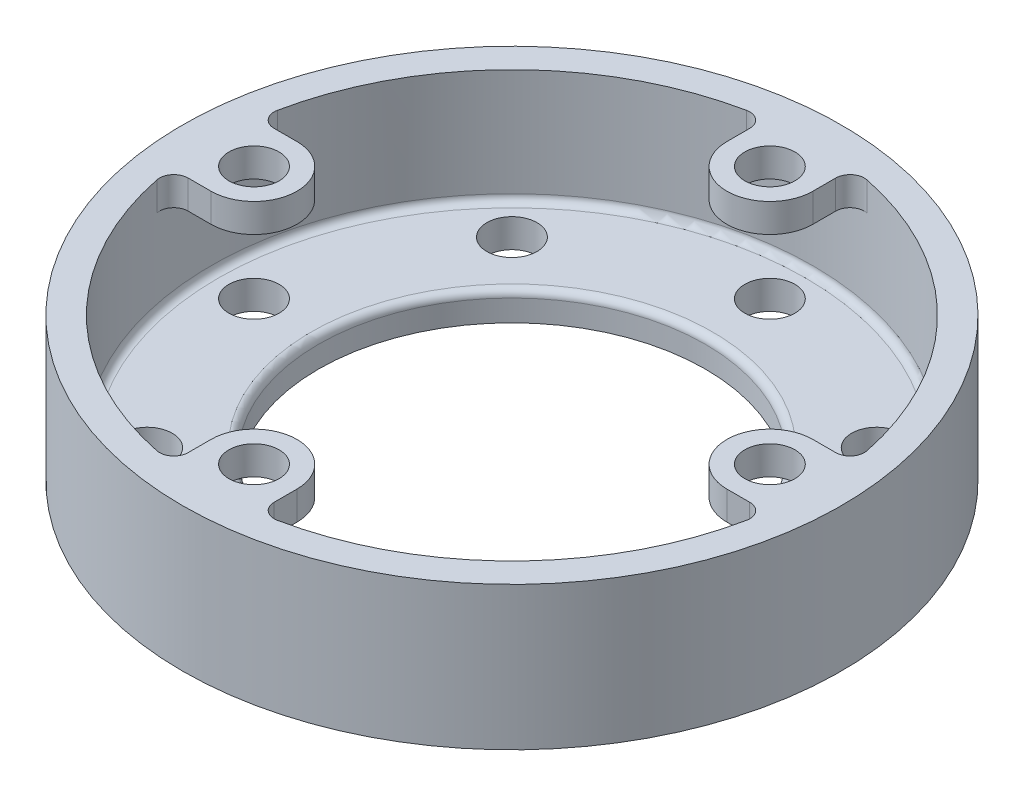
SolidWorks part; units mm, degrees
ref_plane "Front" through (0, 0, 0) normal (0, 0, 1) x (1, 0, 0)
ref_plane "Top" through (0, 0, 0) normal (0, 1, 0) x (1, 0, 0)
ref_plane "Right" through (0, 0, 0) normal (1, 0, 0) x (0, 0, -1)
sketch "Sketch1" plane through (0, 0, 0) normal (0, 1, 0) x (1, 0, 0)
  circle A0 centre (0, 0) radius 73.025
  dimension "D1" = 146.05
extrude "Base-Extrude" add sketch "Sketch1" along normal blind 31.75
shell "Shell1" thickness 6.35
sketch "Sketch4" plane through (0, 6.35, 0) normal (0, 1, 0) x (-1, 0, 0)
  circle A0 centre (0, 0) radius 42.8625
  dimension "D1" = 85.725
extrude "Cut-Extrude2" cut sketch "Sketch4" against normal through all
sketch "Sketch2" plane through (0, 31.75, 0) normal (0, 1, 0) x (-1, 0, 0)
  line L0 (0, -73.025) -> (0, 73.025) construction
  line L1 (-9.525, -65.9911) -> (-9.525, -57.15)
  line L2 (9.525, -57.15) -> (9.525, -65.9911)
  circle A0 centre (0, 0) radius 73.025 construction
  arc A1 (-9.525, -65.9911) -> (9.525, -65.9911) centre (0, 0) ccw
  circle A2 centre (0, 0) radius 66.675 construction
  arc A3 (-9.525, -57.15) -> (9.525, -57.15) centre (0, -57.15) cw
  dimension "D2" = 9.525
  dimension "D1" = 57.15
extrude "Boss-Extrude1" add sketch "Sketch2" against normal blind 6.35
sketch "Sketch3" plane through (0, 31.75, 0) normal (0, 1, 0) x (-1, 0, 0)
  circle A0 centre (0, -57.15) radius 5.5563
  arc A2 (9.525, -57.15) -> (-9.525, -57.15) centre (0, -57.15) ccw construction
  dimension "D1" = 11.1125
extrude "Cut-Extrude1" cut sketch "Sketch3" against normal up to next
fillet "Fillet1" radius 3.175 2 edges at (-9.525, 28.575, -65.9911) (9.525, 28.575, -65.9911)
pattern_circular "CirPattern1" count 4 every 90 about axis through (0, 0, 0) along (0, 1, 0) of "Fillet1", "Boss-Extrude1", "Cut-Extrude1"
sketch "Sketch5" plane through (0, 6.35, 0) normal (0, 1, 0) x (-1, 0, 0)
  circle A0 centre (0, -57.15) radius 5.5563 construction
  circle A1 centre (0, -57.15) radius 5.5562
extrude "Cut-Extrude3" cut sketch "Sketch5" against normal through all
pattern_circular "CirPattern2" count 8 every 45 about axis through (0, 0, 0) along (0, 1, 0) of "Cut-Extrude3"
fillet "Fillet2" radius 1.5875 2 edges at (0, 6.35, 66.675) (0, 6.35, 42.8625)
